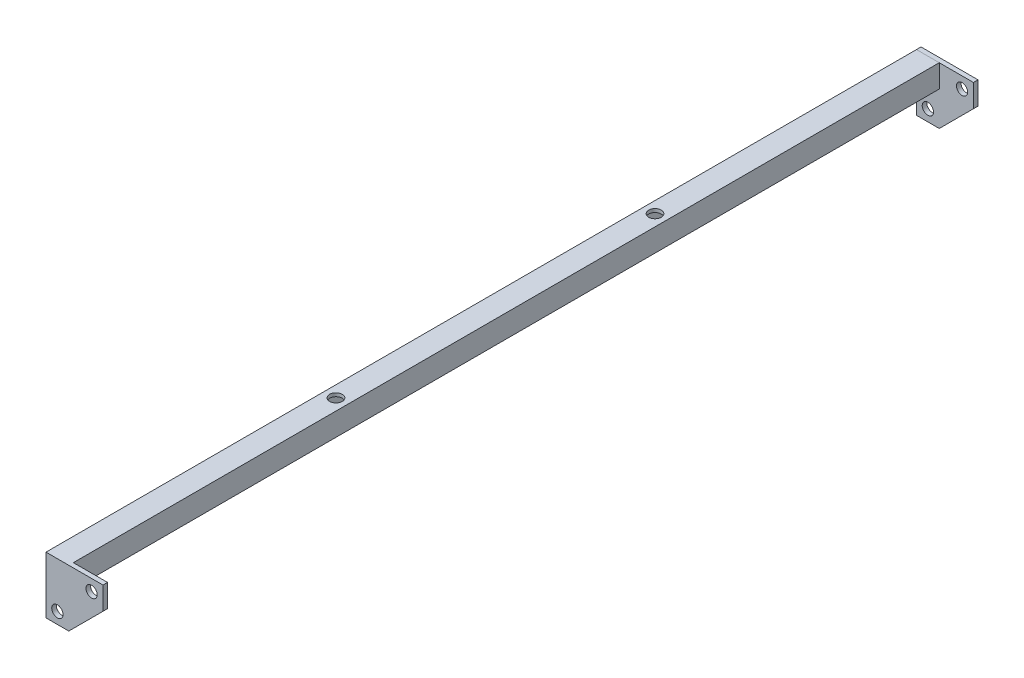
SolidWorks part; units mm, degrees
ref_plane "Plan de face" through (0, 0, 0) normal (0, 0, 1) x (1, 0, 0)
ref_plane "Plan de dessus" through (0, 0, 0) normal (0, 1, 0) x (1, 0, 0)
ref_plane "Plan de droite" through (0, 0, 0) normal (1, 0, 0) x (0, 0, -1)
sketch "Esquisse1" plane through (0, 0, 0) normal (0, 0, 1) x (1, 0, 0)
  line L0 (0, 770) -> (0, 720)
  line L1 (0, 0) -> (0, 770) construction
  line L2 (0, 720) -> (20, 720)
  line L3 (20, 720) -> (50, 750)
  line L4 (0, 770) -> (50, 770)
  line L5 (0, 770) -> (718.58, 770) construction
  line L6 (50, 770) -> (50, 750)
  circle A0 centre (10, 730) radius 4.9731 construction
  circle A1 centre (40, 760) radius 4.9036 construction
  circle A2 centre (10, 730) radius 4.9731
  circle A3 centre (40, 760) radius 4.9036
  dimension "D1" = 50
  dimension "D2" = 50
  dimension "D3" = 135
  dimension "D4" = 20
extrude "Extrusion1" add sketch "Esquisse1" along normal blind 4
sketch "Esquisse3" plane through (0, 0, 768) normal (0, 0, -1) x (-1, 0, 0)
  line L5 (0, 770) -> (0, 720)
  line L6 (0, 720) -> (-20, 720)
  line L7 (-20, 720) -> (-50, 750)
  line L8 (-50, 750) -> (-50, 770)
  line L9 (-50, 770) -> (0, 770)
  circle A3 centre (-40, 760) radius 4.9036
  circle A4 centre (-10, 730) radius 4.9731
extrude "Extrusion3" add sketch "Esquisse3" along normal blind 4
sketch "Esquisse2" plane through (0, 0, 4) normal (0, 0, 1) x (1, 0, 0)
  line L0 (17, 767) -> (17, 753)
  line L1 (0, 770) -> (20, 770)
  line L2 (0, 770) -> (0, 750)
  line L3 (0, 750) -> (20, 750)
  line L4 (20, 770) -> (20, 750)
  line L5 (3, 753) -> (17, 753)
  line L6 (3, 767) -> (3, 753)
  line L7 (3, 767) -> (17, 767)
  line L8 (0, 770) -> (0, 720) construction
  line L9 (50, 770) -> (0, 770) construction
  dimension "D1" = 20
  dimension "D2" = 20
  dimension "D3" = 3
extrude "Extrusion4" add sketch "Esquisse2" along normal up to surface (760 mm away)
sketch "Esquisse5" plane through (0, 770, 0) normal (0, 1, 0) x (-1, 0, 0)
  circle A0 centre (-10, 243.5) radius 5.5 construction
  circle A1 centre (-10, 243.5) radius 5.5
  circle A2 centre (-10, 523.5) radius 5.5 construction
  circle A3 centre (-10, 523.5) radius 5.5
extrude "Enlèv. mat.-Extru.1" cut sketch "Esquisse5" against normal through all
sketch "Esquisse6" plane through (0, 0, 693) normal (0, 0, 1) x (1, 0, 0)
  line L1 (50, 750) -> (0, 750)
  line L2 (50, 750) -> (50, 719.0968)
  line L3 (50, 719.0968) -> (0, 719.0968)
  line L4 (0, 750) -> (0, 719.0968)
extrude "Enlèv. mat.-Extru.2" cut sketch "Esquisse6" against normal through all
